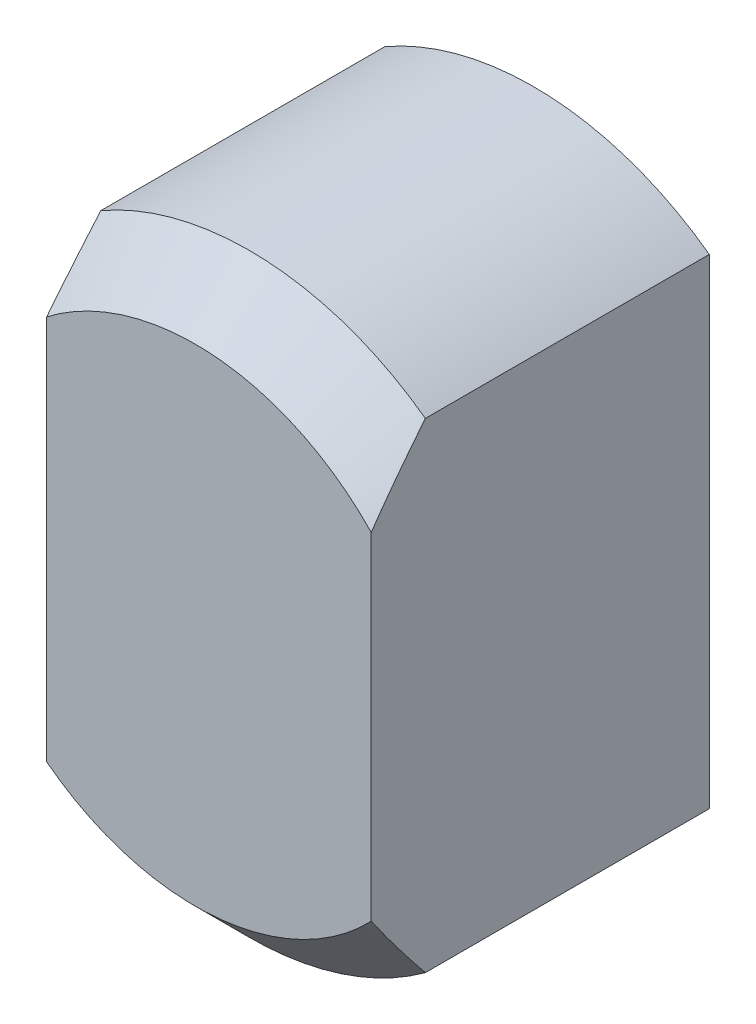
SolidWorks part; units mm, degrees
ref_plane "Front Plane" through (0, 0, 0) normal (0, 0, 1) x (1, 0, 0)
ref_plane "Top Plane" through (0, 0, 0) normal (0, 1, 0) x (1, 0, 0)
ref_plane "Right Plane" through (0, 0, 0) normal (1, 0, 0) x (0, 0, -1)
sketch "Sketch1" plane through (0, 0, 0) normal (0, 0, 1) x (1, 0, 0)
  line L1 (-69.85, 120.9837) -> (-69.85, -120.9837)
  line L2 (-69.85, 0) -> (82.55, 0) construction
  line L3 (82.55, -112.7013) -> (82.55, 112.7013)
  arc A0 (82.55, 112.7013) -> (-69.85, 120.9837) centre (0, 0) ccw
  arc A1 (82.55, -112.7013) -> (-69.85, -120.9837) centre (0, 0) cw
  dimension "D1" = 139.7
  dimension "D2" = 69.85
  dimension "D3" = 82.55
extrude "Boss-Extrude1" add sketch "Sketch1" along normal blind 158.75
chamfer "Chamfer1" distance 25.4 angle 45 2 edges at (7.581, 139.4941, 158.75) (7.581, -139.4941, 158.75)
